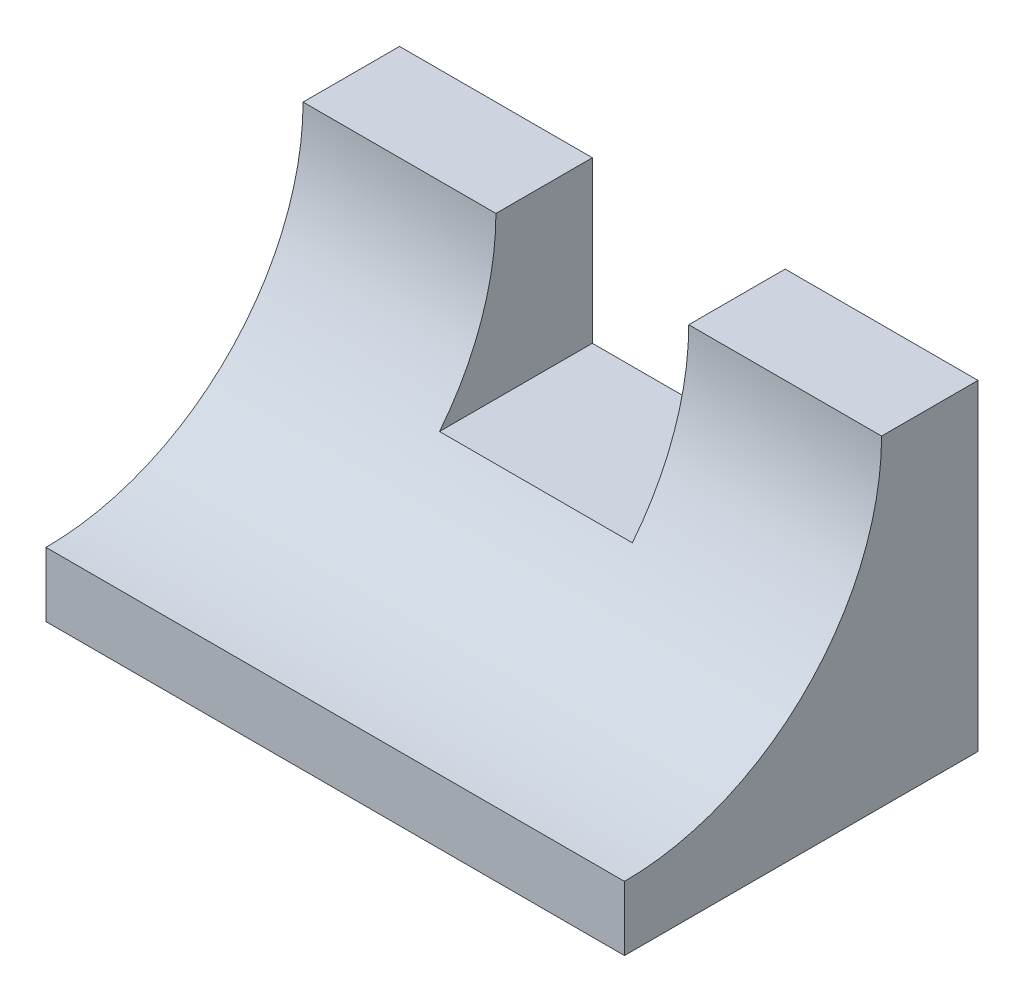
SolidWorks part; units mm, degrees
ref_plane "前视基准面" through (0, 0, 0) normal (0, 0, 1) x (1, 0, 0)
ref_plane "上视基准面" through (0, 0, 0) normal (0, 1, 0) x (1, 0, 0)
ref_plane "右视基准面" through (0, 0, 0) normal (1, 0, 0) x (0, 0, -1)
sketch "草图1" plane through (0, 0, 0) normal (0, 1, 0) x (1, 0, 0)
  line L1 (0, 0) -> (90, 0)
  line L2 (0, 0) -> (0, 55)
  line L3 (0, 55) -> (90, 55)
  line L4 (90, 0) -> (90, 55)
  dimension "D1" = 90
  dimension "D2" = 55
extrude "拉伸1" add sketch "草图1" along normal blind 50
sketch "草图2" plane through (90, 0, 0) normal (1, 0, 0) x (0, 0, -1)
  circle A0 centre (0, 50) radius 40
  dimension "D1" = 80
extrude "切除-拉伸1" cut sketch "草图2" against normal through all
sketch "草图3" plane through (0, 0, 0) normal (0, 0, 1) x (1, 0, 0)
  line L0 (0, 50) -> (90, 50) construction
  line L1 (30, 50) -> (60, 50)
  line L2 (30, 50) -> (30, 25)
  line L3 (30, 25) -> (60, 25)
  line L4 (60, 50) -> (60, 25)
  line L5 (45, 10) -> (45, 16.523) construction
  line L6 (90, 10) -> (0, 10) construction
  dimension "D1" = 30
  dimension "D2" = 25
extrude "切除-拉伸2" cut sketch "草图3" against normal through all
